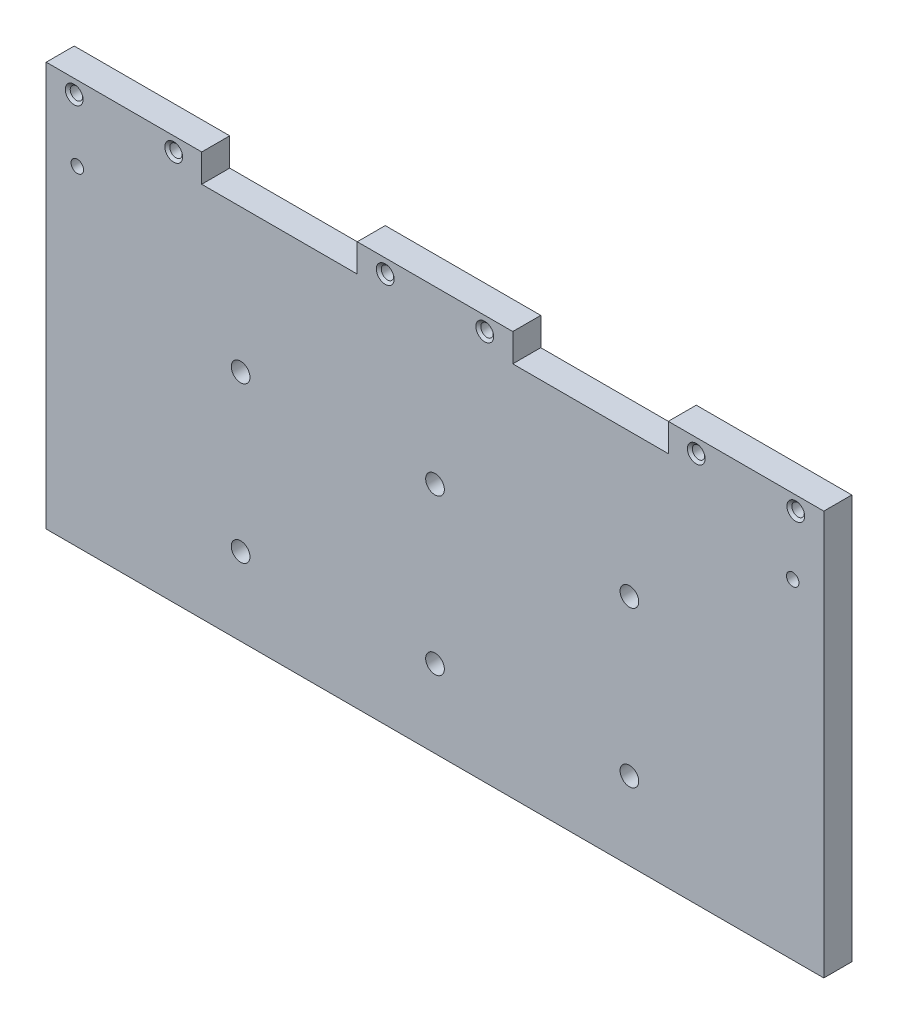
SolidWorks part; units mm, degrees
ref_plane "Спереди" through (0, 0, 0) normal (0, 0, 1) x (1, 0, 0)
ref_plane "Сверху" through (0, 0, 0) normal (0, 1, 0) x (1, 0, 0)
ref_plane "Справа" through (0, 0, 0) normal (1, 0, 0) x (0, 0, -1)
sketch "Эскиз1" plane through (0, 0, 0) normal (0, 0, 1) x (1, 0, 0)
  line L0 (-49.0031, 68.9523) -> (0.9969, 68.9523)
  line L1 (0.9969, 68.9523) -> (0.9969, 59.9523)
  line L2 (-49.0031, 68.9523) -> (-49.0031, -61.0477)
  line L3 (-49.0031, -61.0477) -> (200.9969, -61.0477)
  line L4 (200.9969, 68.9523) -> (200.9969, -61.0477)
  line L5 (0.9969, 59.9523) -> (50.9969, 59.9523)
  line L6 (50.9969, 59.9523) -> (50.9969, 68.9523)
  line L7 (50.9969, 68.9523) -> (100.9969, 68.9523)
  line L8 (100.9969, 68.9523) -> (100.9969, 59.9523)
  line L9 (100.9969, 59.9523) -> (150.9969, 59.9523)
  line L10 (150.9969, 59.9523) -> (150.9969, 68.9523)
  line L11 (150.9969, 68.9523) -> (200.9969, 68.9523)
extrude "Бобышка-Вытянуть1" add sketch "Эскиз1" along normal blind 9
sketch "Эскиз2" plane through (0, 0, 9) normal (0, 0, 1) x (1, 0, 0)
  line L0 (75.9969, 68.9523) -> (75.9969, -49.0933) construction
  line L1 (100.9969, 68.9523) -> (50.9969, 68.9523) construction
  line L2 (75.9969, 64.4523) -> (59.9969, 64.4523) construction
  line L5 (-24.0031, 68.9523) -> (-24.0031, 52.1288) construction
  line L6 (0.9969, 68.9523) -> (-49.0031, 68.9523) construction
  line L7 (-24.0031, 64.4523) -> (-8.0031, 64.4523) construction
  line L8 (-24.0031, 64.4523) -> (-40.0031, 64.4523) construction
  circle A0 centre (59.9969, 64.4523) radius 2
  circle A1 centre (-8.0031, 64.4523) radius 2
  circle A2 centre (-40.0031, 64.4523) radius 2
  circle A3 centre (91.9969, 64.4523) radius 2
  circle A4 centre (191.9969, 64.4523) radius 2
  circle A5 centre (159.9969, 64.4523) radius 2
extrude "Вырез-Вытянуть2" cut sketch "Эскиз2" against normal blind 9
hole_wizard "Зенковка для  винта с плоской головкой #4(100)2" positions "Трехмерный эскиз2" profile "Эскиз10" countersink size "#4" standard "Ansi Inch"
sketch3d "Трехмерный эскиз2"
  line L0 (-40.0031, 64.4523, 0) -> (-40.0031, 64.4523, 9) construction
  line L1 (-8.0031, 64.4523, 0) -> (-8.0031, 64.4523, 9) construction
  line L2 (59.9969, 64.4523, 0) -> (59.9969, 64.4523, 9) construction
  line L3 (91.9969, 64.4523, 0) -> (91.9969, 64.4523, 9) construction
  line L4 (191.9969, 64.4523, 0) -> (191.9969, 64.4523, 9) construction
  line L5 (159.9969, 64.4523, 0) -> (159.9969, 64.4523, 9) construction
  point P5 (-40.0031, 64.4523, 9)
  point P9 (-8.0031, 64.4523, 9)
  point P13 (59.9969, 64.4523, 9)
  point P17 (91.9969, 64.4523, 9)
  point P21 (191.9969, 64.4523, 9)
  point P25 (159.9969, 64.4523, 9)
sketch "Эскиз10" plane through (-40.0031, 64.4523, 9) normal (1, 0, 0) x (0, -1, 0)
  line L0 (0, 0) -> (0, 9)
  line L1 (0, 9) -> (1.632, 9)
  line L2 (1.632, 9) -> (1.6319, 1.0284)
  line L3 (1.6319, 1.0284) -> (2.8575, 0)
  line L5 (2.8575, 0) -> (0, 0)
  line L6 (-1.6319, 1.0284) -> (-2.8575, 0) construction
  line L11 (0, -6.35) -> (0, 107.95) construction
  dimension "Диаметр сквозного отверстия" = 3.2639
  dimension "Глубина сквозного отверстия" = 9
  dimension "Диаметр передней зенковки" = 5.715
  dimension "Угол передней зенковки" = 100
sketch "Эскиз11" plane through (0, 0, 0) normal (0, 0, -1) x (-1, 0, 0)
  circle A0 centre (-190.9969, 44.9523) radius 2
  circle A1 centre (39.0031, 44.9523) radius 2
extrude "Вырез-Вытянуть3" cut sketch "Эскиз11" against normal blind 10 contours A0 | A1
sketch "Эскиз12" plane through (0, 0, 0) normal (0, 0, -1) x (-1, 0, 0)
  circle A0 centre (-138.4969, 13.9523) radius 3
  circle A1 centre (-75.9969, -36.0477) radius 3
  circle A2 centre (-75.9969, 13.9523) radius 3
  circle A3 centre (-138.4969, -36.0477) radius 3
  circle A4 centre (-13.4969, 13.9523) radius 3
  circle A5 centre (-13.4969, -36.0477) radius 3
extrude "Вырез-Вытянуть4" cut sketch "Эскиз12" against normal blind 10
